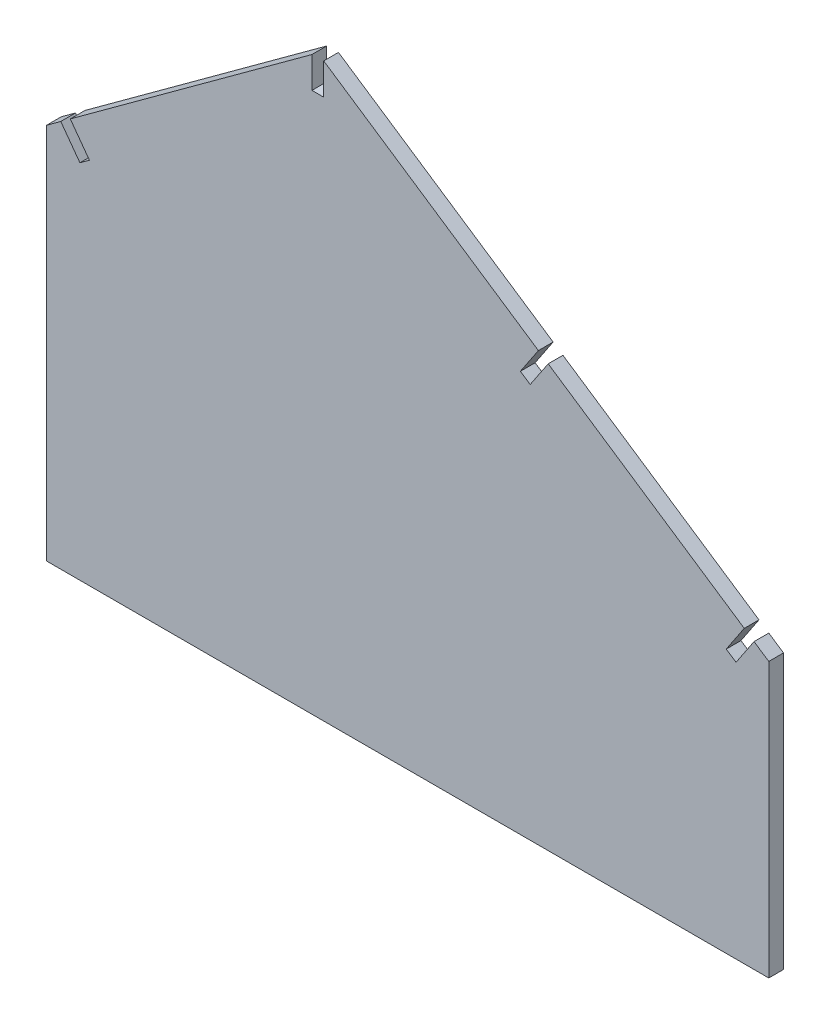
SolidWorks part; units mm, degrees
ref_plane "Plan de face" through (0, 0, 0) normal (0, 0, 1) x (1, 0, 0)
ref_plane "Plan de dessus" through (0, 0, 0) normal (0, 1, 0) x (1, 0, 0)
ref_plane "Plan de droite" through (0, 0, 0) normal (1, 0, 0) x (0, 0, -1)
sketch "Esquisse1" plane through (0, 0, 0) normal (0, 0, 1) x (1, 0, 0)
  line L20 (-92.0383, -72.8862) -> (152.9617, -72.8862)
  line L21 (152.9617, -72.8862) -> (152.9617, 20.1138)
  line L22 (152.9617, 20.1138) -> (147.9739, 23.4486)
  line L23 (138.5348, 16.5274) -> (141.86, 14.3042)
  line L24 (147.9739, 23.4486) -> (141.86, 14.3042)
  line L25 (138.5348, 16.5274) -> (144.6486, 25.6719)
  line L26 (144.6486, 25.6719) -> (78.1435, 70.1361)
  line L27 (78.1435, 70.1361) -> (72.0297, 60.9917)
  line L28 (68.7044, 63.2149) -> (72.0297, 60.9917)
  line L29 (68.7044, 63.2149) -> (74.8182, 72.3593)
  line L30 (74.8182, 72.3593) -> (2, 121.0445)
  line L31 (2, 110.3816) -> (2, 121.0445)
  line L32 (-2, 110.3816) -> (2, 110.3816)
  line L33 (-2, 120.9199) -> (-2, 110.3816)
  line L34 (-2, 120.9199) -> (-83.9647, 61.0145)
  line L35 (-83.9647, 61.0145) -> (-77.474, 52.1336)
  line L36 (-80.7034, 49.7733) -> (-77.474, 52.1336)
  line L37 (-80.7034, 49.7733) -> (-87.1941, 58.6542)
  line L38 (-87.1941, 58.6542) -> (-92.0383, 55.1138)
  line L39 (-92.0383, 55.1138) -> (-92.0383, -72.8862)
extrude "Extrusion1" add sketch "Esquisse1" along normal blind 5
